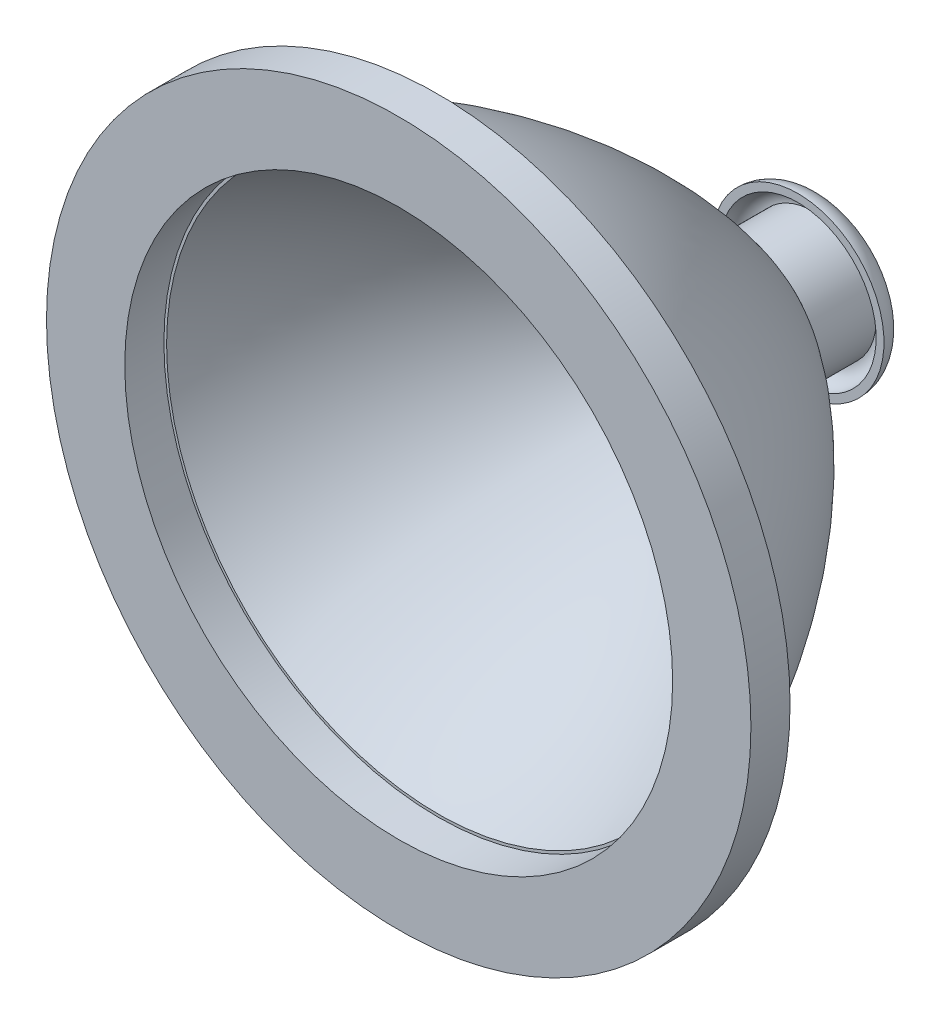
SolidWorks part; units mm, degrees
ref_plane "Front Plane" through (0, 0, 0) normal (0, 0, 1) x (1, 0, 0)
ref_plane "Top Plane" through (0, 0, 0) normal (0, 1, 0) x (1, 0, 0)
ref_plane "Right Plane" through (0, 0, 0) normal (1, 0, 0) x (0, 0, -1)
sketch "Sketch4" plane through (0, 0, 0) normal (1, 0, 0) x (0, 0, -1)
  line L0 (-65.5374, 0) -> (66.3176, 0) construction
  line L1 (0, 50.8) -> (0, 0)
  line L2 (0, 55) -> (0, -55) construction
  line L3 (0, 0) -> (50.8, 0)
  line L4 (50.8, 0) -> (50.8, 10.16)
  arc A0 (0, 50.8) -> (50.8, 10.16) centre (-34.7283, -44.6804) cw
  dimension "D3" = 101.6
  dimension "D1" = 50.8
  dimension "D2" = 10.16
revolve "BaseRevolve" add sketch "Sketch4" angle 360 about L0
shell "LensShell" thickness 6.35
sketch "Sketch5" plane through (0, 0, -50.8) normal (0, 0, -1) x (-1, 0, 0)
  circle A1 centre (0, 0) radius 10.16
  circle A2 centre (0, 0) radius 10.16
  dimension "D1" = 0
extrude "lens Neck" add sketch "Sketch5" along normal blind 10.16 contours A2
hole_wizard "BulbHole" positions "Sketch6" profile "Sketch7" counterbore size "1/2" standard "ANSI Inch"
sketch "Sketch6" plane through (0, 0, -44.45) normal (0, 0, 1) x (1, 0, 0)
  point P0 (0, 0)
sketch "Sketch7" plane through (0, 0, -44.45) normal (1, 0, 0) x (0, -1, 0)
  line L0 (0, 0) -> (0, 16.51)
  line L1 (0, 16.51) -> (6.7462, 16.51)
  line L3 (6.7462, 16.51) -> (6.7462, 5.08)
  line L4 (6.7462, 5.08) -> (7.62, 5.08)
  line L5 (7.62, 5.08) -> (7.62, 0)
  line L7 (7.62, 0) -> (0, 0)
  line L11 (0, -6.35) -> (0, 107.95) construction
  dimension "Thru Hole Dia." = 13.4925
  dimension "Thru Hole Depth" = 16.51
  dimension "C'Bore Dia." = 15.24
  dimension "C'Bore Depth" = 5.08
sketch "Sketch8" plane through (0, 0, 0) normal (1, 0, 0) x (0, 0, -1)
  line L0 (60.96, 10.16) -> (50.8, 10.16) construction
  arc A0 (60.96, 10.16) -> (58.42, 12.7) centre (58.42, 10.16) ccw
  dimension "D1" = 2.54
revolve "Lens Connector" add sketch "Sketch8" angle 360 mid plane
sketch "Sketch9" plane through (0, 0, 0) normal (0, 0, 1) x (1, 0, 0)
  circle A2 centre (0, 0) radius 57.15
  circle A3 centre (0, 0) radius 57.15
  circle A4 centre (0, 0) radius 44.45
  circle A5 centre (0, 0) radius 44.45
  dimension "D1" = 6.35
  dimension "D2" = 6.35
extrude "LensCover" add sketch "Sketch9" along normal blind 6.35
sketch "Sketch10" plane through (0, 0, 0) normal (0, 0, 1) x (1, 0, 0)
  circle A1 centre (0, 0) radius 57.15
  circle A2 centre (0, 0) radius 57.15
  dimension "D1" = 0
extrude "LensShield" [suppressed] add sketch "Sketch10" along normal blind 2.54
